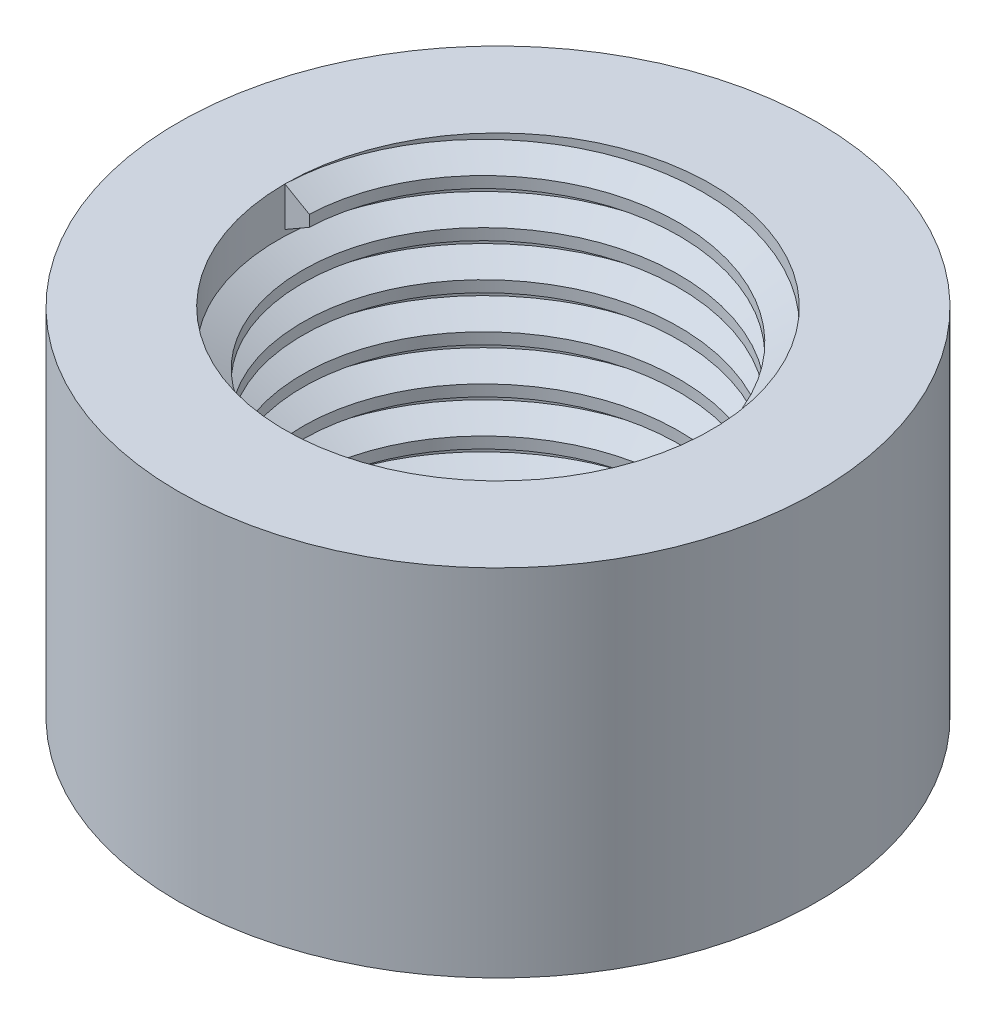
SolidWorks part; units mm, degrees
ref_plane "Front Plane" through (0, 0, 0) normal (0, 0, 1) x (1, 0, 0)
ref_plane "Top Plane" through (0, 0, 0) normal (0, 1, 0) x (1, 0, 0)
ref_plane "Right Plane" through (0, 0, 0) normal (1, 0, 0) x (0, 0, -1)
sketch "Sketch1" plane through (0, 0, 0) normal (0, 1, 0) x (1, 0, 0)
  circle A0 centre (0, 0) radius 2.25
  circle A1 centre (0, 0) radius 1.5
  dimension "D1" = 4.5
  dimension "D2" = 3
extrude "Boss-Extrude1" add sketch "Sketch1" along normal blind 2.5 contours A0
thread "Thread1" pitch 0.3175 start angle 0, offset 0, length 2.5, pitch 0.3175, diameter 3
ref_plane "Plane1" through (-1.5, 2.5, 0) normal (0, 0, 1) x (-1, 0, 0)
sketch "Thread Profile1" plane through (-1.5, 2.5, 0) normal (0, 0, 1) x (-1, 0, 0)
  line L0 (0, 0) -> (0, 0.3175) construction
  line L11 (0, 0) -> (0, 0.2778)
  line L12 (0, 0.2778) -> (-0.1719, 0.1786)
  line L13 (-0.1719, 0.1786) -> (-0.1719, 0.0992)
  line L15 (-0.1719, 0.0992) -> (0, 0)
  line L17 (-0.1719, 0.1389) -> (0, 0.1389) construction
  point P2 (0, 0)
  dimension "Pitch" = 0.3175
  dimension "Profile_Angle" = 60
  dimension "Profile_Land" = 0.0794
  dimension "Profile_Height" = 0.1719
